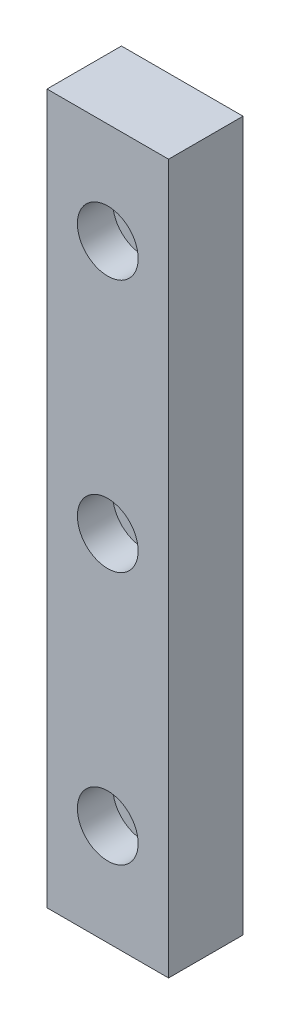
SolidWorks part; units mm, degrees
ref_plane "前视基准面" through (0, 0, 0) normal (0, 0, 1) x (1, 0, 0)
ref_plane "上视基准面" through (0, 0, 0) normal (0, 1, 0) x (1, 0, 0)
ref_plane "右视基准面" through (0, 0, 0) normal (1, 0, 0) x (0, 0, -1)
sketch "草图1" plane through (0, 0, 0) normal (0, 0, 1) x (1, 0, 0)
  line L0 (12, 70) -> (0, 70)
  line L1 (12, 0) -> (0, 0)
  line L2 (0, 70) -> (0, 0)
  line L3 (12, 70) -> (12, 0)
  circle A0 centre (6, 60) radius 1.75
  circle A1 centre (6, 35) radius 1.75
  circle A2 centre (6, 10) radius 1.75
extrude "凸台-拉伸1" add sketch "草图1" along normal blind 7.35
sketch "草图2" plane through (0, 0, 7.35) normal (0, 0, 1) x (1, 0, 0)
  circle A0 centre (6, 60) radius 3
  circle A1 centre (6, 35) radius 3
  circle A2 centre (6, 10) radius 3
extrude "切除-拉伸1" cut sketch "草图2" against normal blind 3.5
